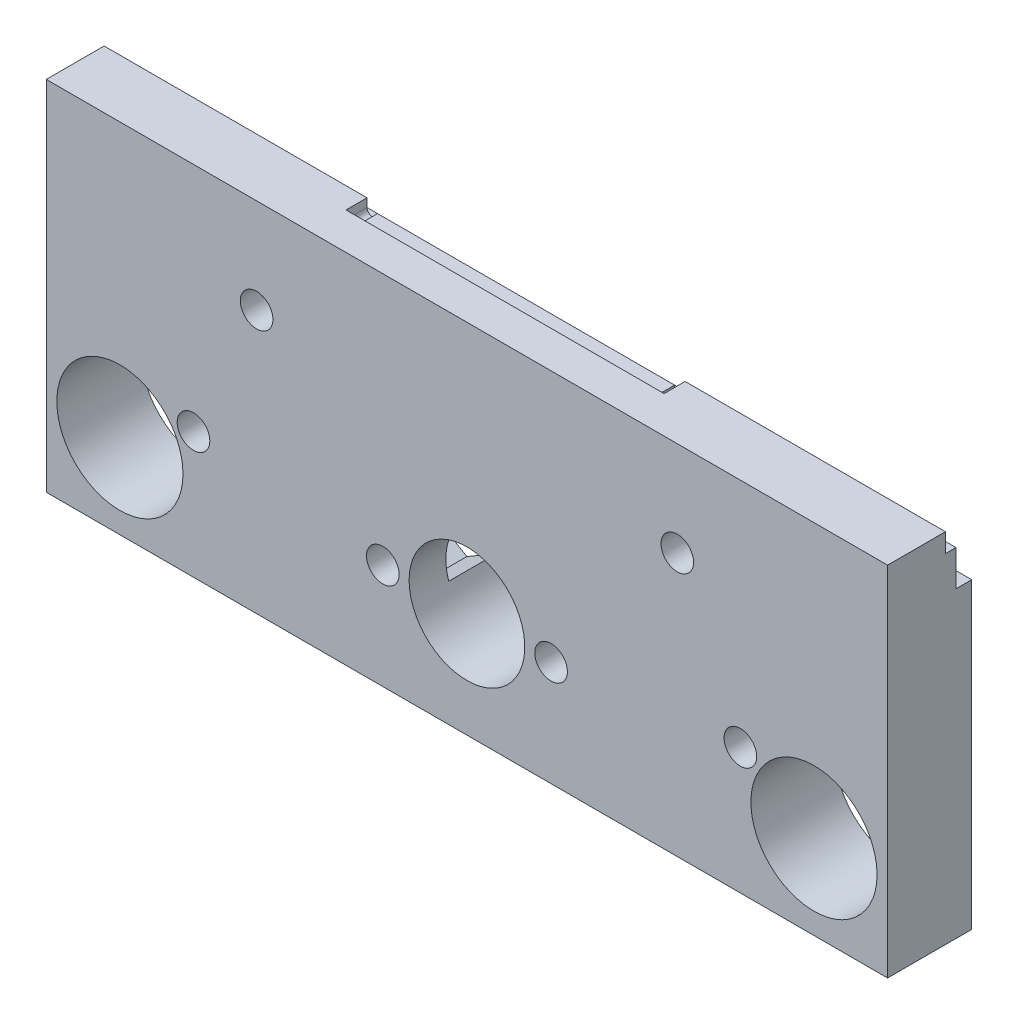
SolidWorks part; units mm, degrees
ref_plane "前视基准面" through (0, 0, 0) normal (0, 0, 1) x (1, 0, 0)
ref_plane "上视基准面" through (0, 0, 0) normal (0, 1, 0) x (1, 0, 0)
ref_plane "右视基准面" through (0, 0, 0) normal (1, 0, 0) x (0, 0, -1)
sketch "前视图草图" plane through (0, 0, 0) normal (0, 0, 1) x (1, 0, 0)
  line L0 (0, 0) -> (44.4821, 0) construction
  line L1 (0, 0) -> (0, 28.3185) construction
sketch "草图2" plane through (0, 0, 0) normal (0, 0, 1) x (1, 0, 0)
  line L0 (0, 0) -> (80, 0)
  line L1 (-200000, 0) -> (200044.4821, 0) construction
  line L2 (80, 0) -> (80, 34)
  line L3 (80, 34) -> (0, 34)
  line L4 (0, -200000) -> (0, 200028.3185) construction
  line L5 (0, 34) -> (0, 0)
  circle A0 centre (7, 8) radius 6
  circle A1 centre (40, 10) radius 4.05
  circle A2 centre (73, 8) radius 6
  dimension "D3" = 8
  dimension "D5" = 10
  dimension "D9" = 12
  dimension "D10" = 12
  dimension "D11" = 8.1
  dimension "D1" = 34
  dimension "D2" = 80
  dimension "D4" = 7
  dimension "D6" = 7
  dimension "D7" = 8
  dimension "D8" = 40
extrude "凸台-拉伸1" add sketch "草图2" along normal blind 8
sketch "草图3" plane through (0, 0, 8) normal (0, 0, 1) x (1, 0, 0)
  line L0 (16.088, 8) -> (31.4805, 8) construction
  line L1 (7, 8) -> (7, 16.8386) construction
  line L2 (73, 8) -> (73, 16.5917) construction
  line L4 (-200000, 0) -> (200044.4821, 0) construction
  circle A2 centre (23, 8) radius 2.55
  circle A3 centre (57, 8) radius 2.55
  dimension "D4" = 5.1
  dimension "D5" = 5.1
  dimension "D1" = 8
  dimension "D2" = 16
  dimension "D3" = 16
extrude "切除-拉伸1" [suppressed] cut sketch "草图3" against normal through all
sketch "草图4" plane through (80, 0, 0) normal (1, 0, 0) x (0, 0, -1)
  line L1 (0, -200000) -> (0, 200028.3185) construction
  line L2 (-1.5, 32.2) -> (-2.5, 32.2)
  line L3 (-2.5, 32.2) -> (-2.5, 34)
  line L4 (-8, 34) -> (0, 34) construction
  line L5 (-2.5, 34) -> (0, 34)
  line L6 (-1.5, 32.2) -> (-1.5, 28.8)
  line L7 (-1.5, 28.8) -> (0, 28.8)
  line L8 (0, 28.8) -> (0, 34)
  dimension "D1" = 3.4
  dimension "D2" = 2.5
  dimension "D3" = 1.5
  dimension "D4" = 1.8
extrude "切除-拉伸2" cut sketch "草图4" against normal through all
sketch "草图5" plane through (0, 0, 8) normal (0, 0, 1) x (1, 0, 0)
  line L0 (40, 10) -> (56.5376, 10) construction
  circle A0 centre (40, 10) radius 8 construction
  circle A1 centre (48, 10) radius 1.55
  circle A2 centre (32, 10) radius 1.55
  dimension "D1" = 3.1
  dimension "D2" = 3.1
  dimension "D3" = 16
extrude "切除-拉伸3" cut sketch "草图5" against normal through all
sketch "草图7" [suppressed] plane through (0, 0, 0) normal (0, 0, -1) x (-1, 0, 0)
  line L0 (-40, 12) -> (-40, -8.3696) construction
  line L1 (-23, 10) -> (-23, -2.3368) construction
  line L2 (200000, 0) -> (-200044.4821, 0) construction
  line L6 (-27.05, 10) -> (-27.05, 2.5)
  line L7 (-29.55, 0) -> (-16.45, 0)
  line L8 (-18.95, 2.5) -> (-18.95, 10)
  line L9 (-23, 8) -> (-23, 15.9045) construction
  line L13 (0, -200000) -> (0, 200028.3185) construction
  line L14 (-57, 8) -> (-57, 15.9045) construction
  line L15 (-57, 10) -> (-57, -2.3368) construction
  line L16 (-61.05, 2.5) -> (-61.05, 10)
  line L17 (-50.45, 0) -> (-63.55, 0)
  line L18 (-52.95, 10) -> (-52.95, 2.5)
  arc A1 (-18.95, 10) -> (-27.05, 10) centre (-23, 10) ccw
  arc A4 (-29.55, 0) -> (-27.05, 2.5) centre (-29.55, 2.5) ccw
  arc A5 (-18.95, 2.5) -> (-16.45, 0) centre (-16.45, 2.5) ccw
  arc A7 (-61.05, 2.5) -> (-63.55, 0) centre (-63.55, 2.5) cw
  arc A8 (-50.45, 0) -> (-52.95, 2.5) centre (-50.45, 2.5) cw
  arc A9 (-61.05, 10) -> (-52.95, 10) centre (-57, 10) cw
  dimension "D1" = 40
  dimension "D4" = 8.1
  dimension "D7" = 2.5
  dimension "D8" = 2.5
  dimension "D3" = 10
extrude "切除-拉伸4" [suppressed] cut sketch "草图7" against normal blind 6
sketch "草图8" plane through (0, 0, 0) normal (0, 0, -1) x (-1, 0, 0)
  line L0 (-40, 10) -> (-57.3165, 10) construction
  line L1 (-40, 20) -> (-40, 35.6562) construction
  line L2 (-30.5, 12.85) -> (-49.5, 12.85)
  line L3 (-49.5, 7.15) -> (-30.5, 7.15)
  line L4 (200000, 0) -> (-200044.4821, 0) construction
  line L5 (-80, 0) -> (-80, 28.8) construction
  line L6 (-45.15, 8.3546) -> (-45.15, 11.6454)
  line L7 (-45.15, 11.6454) -> (-48, 13.2909)
  line L8 (-48, 13.2909) -> (-50.85, 11.6454)
  line L9 (-50.85, 11.6454) -> (-50.85, 8.3546)
  line L10 (-50.85, 8.3546) -> (-48, 6.7091)
  line L11 (-48, 6.7091) -> (-45.15, 8.3546)
  line L12 (-34.85, 8.3546) -> (-32, 6.7091)
  line L13 (-32, 6.7091) -> (-29.15, 8.3546)
  line L14 (-29.15, 8.3546) -> (-29.15, 11.6454)
  line L15 (-29.15, 11.6454) -> (-32, 13.2909)
  line L16 (-32, 13.2909) -> (-34.85, 11.6454)
  line L17 (-34.85, 11.6454) -> (-34.85, 8.3546)
  arc A0 (-30.5, 7.15) -> (-30.5, 12.85) centre (-30.5, 10) ccw
  arc A1 (-49.5, 12.85) -> (-49.5, 7.15) centre (-49.5, 10) ccw
  circle A2 centre (-48, 10) radius 2.85 construction
  circle A3 centre (-32, 10) radius 2.85 construction
  dimension "D1" = 5.7
  dimension "D2" = 9.5
  dimension "D3" = 9.5
  dimension "D4" = 10
  dimension "D5" = 5.7
extrude "切除-拉伸5" cut sketch "草图8" against normal blind 4.5 contours L9 L10 L11 L6 L7 L8 | L17 L12 L13 L14 L15 L16
sketch "草图11" plane through (0, 0, 0) normal (0, 0, -1) x (-1, 0, 0)
  line L0 (0, 34) -> (-80, 34) construction
  line L1 (-80, 0) -> (-80, 28.8) construction
  line L2 (0, -200000) -> (0, 200028.3185) construction
  line L3 (-40, 20) -> (-40, 13.5744) construction
  line L4 (-28.772, 25) -> (-45.9396, 25) construction
  circle A0 centre (-60, 25) radius 1.55
  circle A1 centre (-20, 25) radius 1.55
  point P23 (-40, 20)
  dimension "D1" = 3.1
  dimension "D2" = 3.1
  dimension "D3" = 20
  dimension "D4" = 20
  dimension "D5" = 9
sketch "草图20" plane through (0, 0, 0) normal (0, 0, -1) x (-1, 0, 0)
  circle A0 centre (-40, 10) radius 5.5
  dimension "D1" = 11
extrude "切除-拉伸7" cut sketch "草图11" against normal through all contours A0 | A1
sketch "草图12" plane through (0, 0, 0) normal (0, 0, -1) x (-1, 0, 0)
  line L0 (-62.5, 22.15) -> (-57.5, 22.15)
  line L1 (-57.5, 27.85) -> (-62.5, 27.85)
  line L4 (-80, 0) -> (-80, 28.8) construction
  line L5 (-39.1423, 25) -> (-43.2672, 25) construction
  line L6 (-60, 21) -> (-60, 25.2385) construction
  line L7 (-20, 21) -> (-20, 26.1603) construction
  line L8 (-40, 20) -> (-40, 24.3689) construction
  line L9 (-17.5, 27.85) -> (-22.5, 27.85)
  line L10 (-22.5, 22.15) -> (-17.5, 22.15)
  line L11 (0, -200000) -> (0, 200028.3185) construction
  line L12 (0, 34) -> (-80, 34) construction
  arc A0 (-62.5, 27.85) -> (-62.5, 22.15) centre (-62.5, 25) ccw
  arc A1 (-57.5, 22.15) -> (-57.5, 27.85) centre (-57.5, 25) ccw
  arc A4 (-17.5, 22.15) -> (-17.5, 27.85) centre (-17.5, 25) ccw
  arc A5 (-22.5, 27.85) -> (-22.5, 22.15) centre (-22.5, 25) ccw
  point P16 (-38, 21)
  point P28 (-40, 25)
  dimension "D2" = 20
  dimension "D3" = 5
  dimension "D4" = 2.5
  dimension "D5" = 20
  dimension "D6" = 9
  dimension "D1" = 2
sketch "草图19" plane through (0, 0, 2.5) normal (0, 0, -1) x (-1, 0, 0)
  line L0 (0, 34) -> (-80, 34) construction
  line L1 (-25, 34) -> (-55.2479, 34)
  line L2 (-25, 34) -> (-25, 33.2)
  line L3 (-26, 33.2) -> (-54.2479, 33.2)
  line L4 (-55.2479, 34) -> (-55.2479, 33.2)
  line L5 (0, -200000) -> (0, 200028.3185) construction
  line L7 (0, 32.2) -> (-80, 32.2) construction
  line L8 (-56.3335, 32.7) -> (-52.9089, 32.7) construction
  line L9 (-55.2479, 1028.5823) -> (-55.2479, 33.2) construction
  line L10 (-25, 1028.5823) -> (-25, 32.7) construction
  line L11 (-55.2479, 32.7) -> (-55.2479, -973.3) construction
  line L12 (-25, 32.7) -> (-25, -973.3) construction
  arc A3 (-55.2479, 33.2) -> (-54.2479, 33.2) centre (-54.7479, 33.2) ccw
  arc A6 (-26, 33.2) -> (-25, 33.2) centre (-25.5, 33.2) ccw
  dimension "D3" = 1
  dimension "D4" = 1
  dimension "D2" = 0.8
  dimension "D1" = 0.5
  dimension "D9" = 25
extrude "切除-拉伸11" cut sketch "草图19" against normal blind 2
sketch "草图22" plane through (0, 0, 0) normal (0, 0, -1) x (-1, 0, 0)
  line L0 (-66, 0) -> (-66, 28.8) construction
  line L1 (200000, 0) -> (-200044.4821, 0) construction
  line L2 (0, 28.8) -> (-80, 28.8) construction
  line L3 (-80, 12) -> (0, 12) construction
  line L4 (-80, 0) -> (-80, 28.8) construction
  line L5 (0, -200000) -> (0, 200028.3185) construction
  line L7 (-40, 32.2) -> (-40, 0) construction
  line L8 (0, 32.2) -> (-80, 32.2) construction
  line L10 (-40, -199980) -> (-40, 200024.3689) construction
  circle A0 centre (-66, 12) radius 1.55
  circle A1 centre (-14, 12) radius 1.55
  dimension "D3" = 3.1
  dimension "D1" = 12
  dimension "D2" = 14
extrude "切除-拉伸13" cut sketch "草图22" against normal through all
extrude "切除-拉伸14" cut sketch "草图20" against normal through all contours A0
